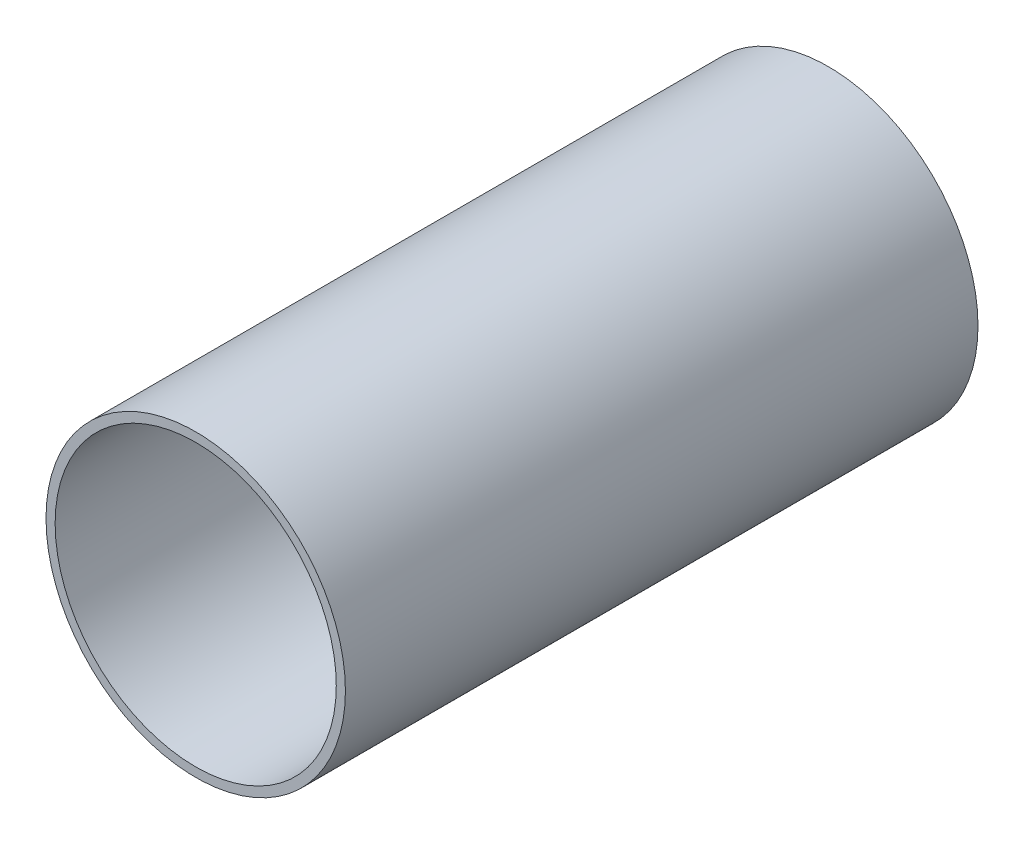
SolidWorks part; units mm, degrees
ref_plane "Front Plane" through (0, 0, 0) normal (0, 0, 1) x (1, 0, 0)
ref_plane "Top Plane" through (0, 0, 0) normal (0, 1, 0) x (1, 0, 0)
ref_plane "Right Plane" through (0, 0, 0) normal (1, 0, 0) x (0, 0, -1)
sketch "Sketch1" plane through (0, 0, 0) normal (0, 0, 1) x (1, 0, 0)
  circle A0 centre (0, 0) radius 27.051
  circle A1 centre (0, 0) radius 25.4
extrude "Extrude1" add sketch "Sketch1" along normal blind 114.3
